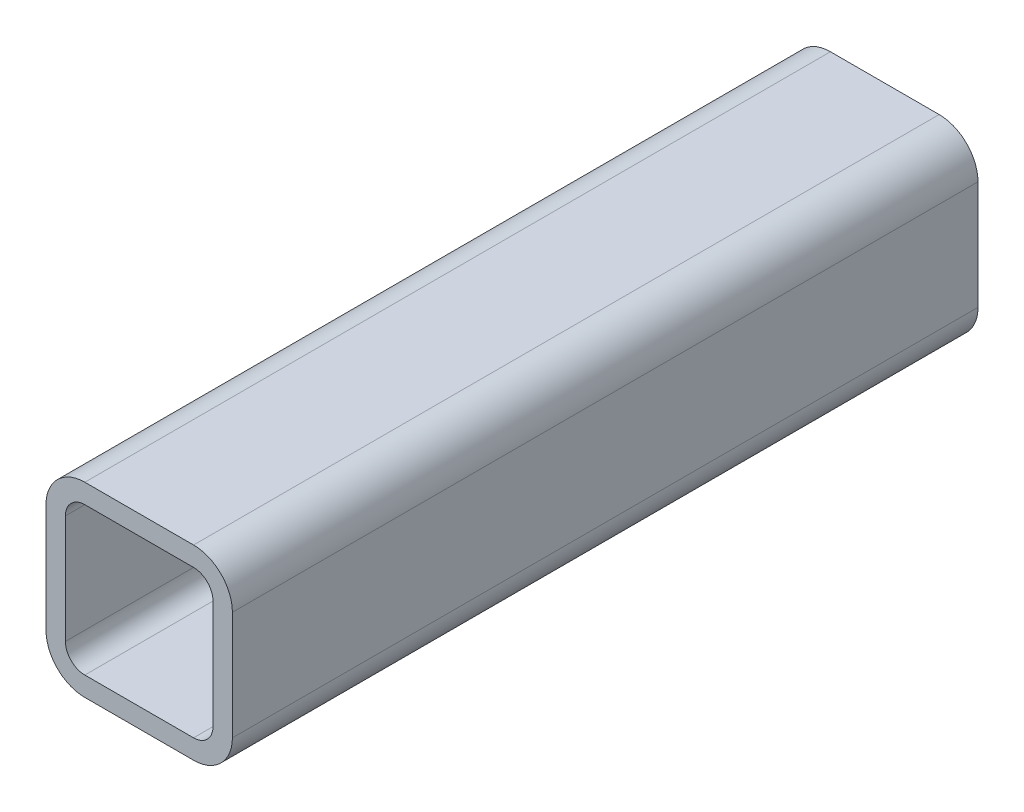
SolidWorks part; units mm, degrees
ref_plane "Front Plane" through (0, 0, 0) normal (0, 0, 1) x (1, 0, 0)
ref_plane "Top Plane" through (0, 0, 0) normal (0, 1, 0) x (1, 0, 0)
ref_plane "Right Plane" through (0, 0, 0) normal (1, 0, 0) x (0, 0, -1)
sketch "Sketch1" plane through (0, 0, 0) normal (0, 0, 1) x (1, 0, 0)
sketch_block_instance "HSS3x3x0.3125-1"
sketch_block "HSS3x3x0.3125"
extrude "Boss-Extrude1" add sketch "Sketch1" along normal blind 304.8
